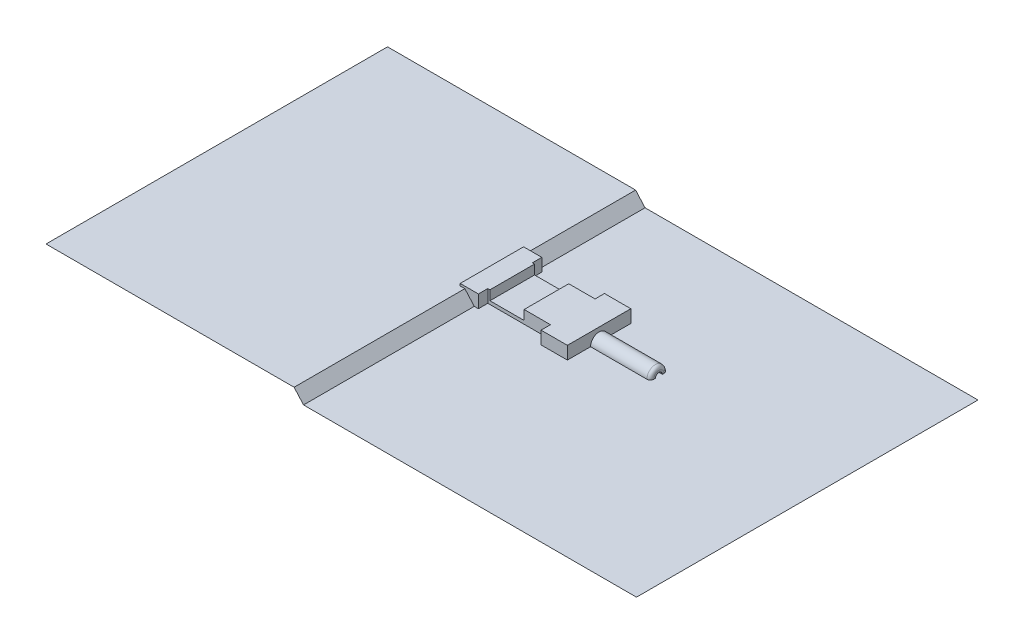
SolidWorks part; units mm, degrees
ref_plane "Ebene vorne" through (0, 0, 0) normal (0, 0, 1) x (1, 0, 0)
ref_plane "Ebene oben" through (0, 0, 0) normal (0, 1, 0) x (1, 0, 0)
ref_plane "Ebene rechts" through (0, 0, 0) normal (1, 0, 0) x (0, 0, -1)
sketch "Skizze1" plane through (0, 0, 0) normal (0, 1, 0) x (1, 0, 0)
  line L0 (40.7087, 0) -> (-40.7087, 0) construction
  line L1 (-40.7087, 18.5695) -> (40.7087, 18.5695)
  line L2 (-40.7087, 18.5695) -> (-40.7087, -18.5695)
  line L3 (-40.7087, -18.5695) -> (40.7087, -18.5695)
  line L4 (40.7087, 18.5695) -> (40.7087, -18.5695)
extrude "Linear austragen1" add sketch "Skizze1" along normal blind 5 and the other way blind 10
sketch "Skizze2" plane through (0, 0, 18.5695) normal (0, 0, 1) x (1, 0, 0)
  line L0 (-40.7087, 0) -> (-22.0775, 0)
  line L1 (-40.7087, 5) -> (-40.7087, -10) construction
  line L2 (-22.0775, 0) -> (-17.9491, -10)
  line L3 (-40.7087, -10) -> (40.7087, -10) construction
  line L4 (-10.1413, 5) -> (-10.1413, -0.5705)
  line L5 (-40.7087, 5) -> (40.7087, 5) construction
  line L6 (-10.1413, -0.5705) -> (9.872, -0.5705)
  line L7 (9.872, -0.5705) -> (9.872, 5)
  line L8 (-7.6284, -10) -> (-7.6284, -6.1347)
  line L9 (-7.6284, -6.1347) -> (6.013, -6.1347)
  line L10 (6.013, -6.1347) -> (6.013, -10)
  line L11 (-10.1413, 5) -> (9.872, 5)
  line L12 (-7.6284, -10) -> (6.013, -10)
  line L13 (-17.9491, -10) -> (-40.7087, -10)
  line L14 (-40.7087, -10) -> (-40.7087, 0)
extrude "Schnitt-Linear austragen1" cut sketch "Skizze2" against normal through all
sketch "Skizze3" plane through (0, 5, 0) normal (0, 1, 0) x (-1, 0, 0)
  line L0 (0, 0) -> (40.7087, 0) construction
  line L1 (34.9005, -8.9429) -> (24.1926, -8.9429)
  line L2 (34.9005, -8.9429) -> (34.9005, 8.9429)
  line L3 (34.9005, 8.9429) -> (24.1926, 8.9429)
  line L4 (24.1926, -8.9429) -> (24.1926, 8.9429)
  line L5 (40.7087, -18.5695) -> (40.7087, 18.5695) construction
  line L6 (-25.2903, 18.5695) -> (-25.2903, 13.058)
  line L7 (-9.872, 18.5695) -> (-40.7087, 18.5695) construction
  line L8 (-25.2903, -18.5695) -> (-25.2903, -13.058)
  line L9 (-25.2903, 13.058) -> (11.3977, 13.058)
  line L10 (-25.2903, -13.058) -> (11.3977, -13.058)
  line L11 (11.3977, 13.058) -> (11.3977, 18.5695)
  line L12 (40.7087, 18.5695) -> (10.1413, 18.5695) construction
  line L13 (11.3977, -13.058) -> (11.3977, -18.5695)
  line L14 (11.3977, 18.5695) -> (-25.2903, 18.5695)
  line L15 (11.3977, -18.5695) -> (-25.2903, -18.5695)
extrude "Schnitt-Linear austragen2" cut sketch "Skizze3" against normal up to next
sketch "Skizze4" plane through (40.7087, 0, 0) normal (1, 0, 0) x (0, 0, -1)
  line L0 (0, -10) -> (0, 5) construction
  line L1 (-18.5695, -10) -> (18.5695, -10) construction
  line L2 (-18.5695, 5) -> (18.5695, 5) construction
  circle A0 centre (0, -2.5) radius 5
  dimension "D1" = 10
extrude "Linear austragen2" add sketch "Skizze4" along normal blind 35
sketch "Skizze6" plane through (0, -10, 0) normal (0, -1, 0) x (1, 0, 0)
  line L0 (40.7087, -5) -> (75.7087, -5) construction
  line L1 (37.7087, 5) -> (28.7663, 5)
  line L2 (37.7087, 5) -> (37.7087, -5)
  line L3 (37.7087, -5) -> (28.7663, -5)
  line L4 (28.7663, 5) -> (28.7663, -5)
  line L5 (75.7087, 5) -> (40.7087, 5) construction
  line L6 (40.7087, 18.5695) -> (40.7087, -18.5695) construction
  dimension "D1" = 3
extrude "Schnitt-Linear austragen3" cut sketch "Skizze6" against normal blind 10
sketch "Skizze5" plane through (75.7087, 0, 0) normal (1, 0, 0) x (0, 0, -1)
  circle A0 centre (0, -2.5) radius 2
extrude "Schnitt-Linear austragen4" cut sketch "Skizze5" against normal up to next
fillet "Verrundung1" radius 2 1 edges at (75.7087, -2.5, -5)
sketch "Skizze8" plane through (0, 0, 18.5695) normal (0, 0, 1) x (1, 0, 0)
  line L0 (-40.7087, 3.7238) -> (-22.0775, 3.7238)
  line L1 (-40.7087, 5) -> (-40.7087, 0) construction
  line L2 (-22.0775, 3.7238) -> (-22.0775, 5)
  line L3 (-40.7087, 5) -> (-11.3977, 5) construction
extrude "Schnitt-Linear austragen5" cut sketch "Skizze8" against normal through all
sketch "Formtrennung" plane through (0, 0, 18.5695) normal (0, 0, 1) x (1, 0, 0)
  line L0 (-40.7087, 3.7238) -> (-19.3296, 3.7238)
  line L1 (75.7087, -2.5) -> (-13.8115, -2.5)
  line L2 (75.7087, -5.5) -> (75.7087, 0.5) construction
  line L3 (-13.8115, -2.5) -> (-19.3296, 3.7238)
  line L4 (-40.7087, 3.7238) -> (-164.6223, 3.7238)
  line L5 (75.7087, -2.5) -> (181.1735, -2.5)
surface "Oberfläche-Linear austragen1" sketch "Formtrennung" parameters "D1"=100, "D2"=100
